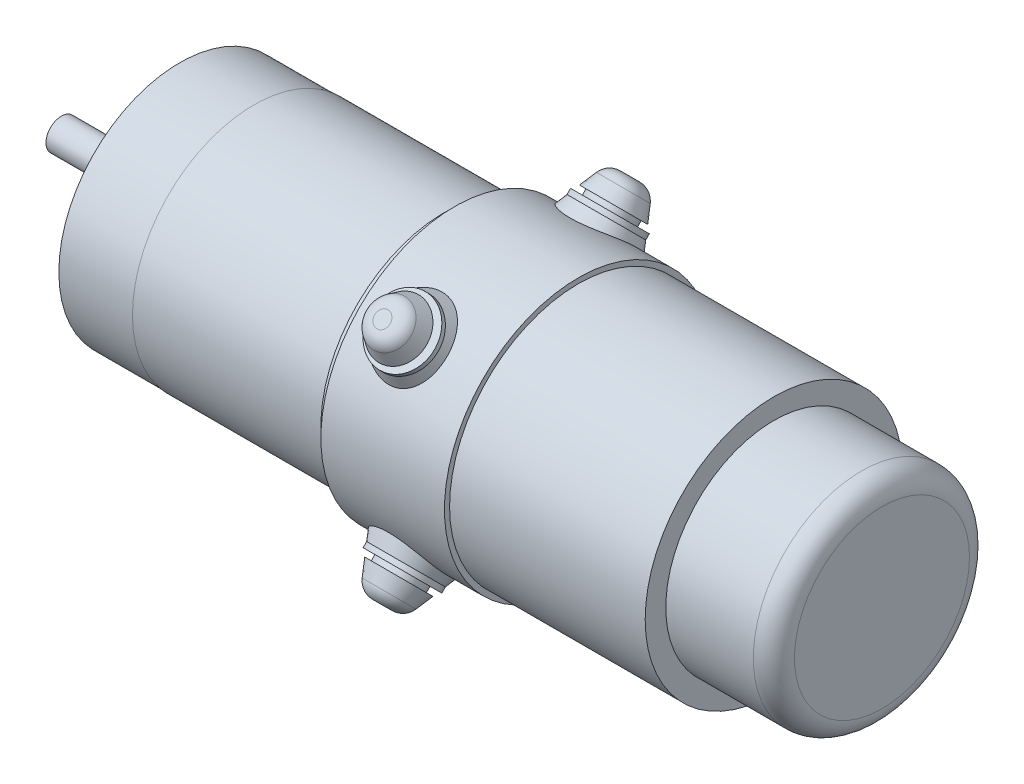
SolidWorks part; units mm, degrees
ref_plane "Plan1" through (0, 0, 0) normal (0, 0, 1) x (1, 0, 0)
ref_plane "Plan2" through (0, 0, 0) normal (0, 1, 0) x (1, 0, 0)
ref_plane "Plan3" through (0, 0, 0) normal (1, 0, 0) x (0, 0, -1)
sketch "Esquisse1" plane through (0, 0, 0) normal (0, 0, 1) x (1, 0, 0)
  line L0 (0, 0) -> (0, 17)
  line L1 (-4, 21) -> (-21, 21)
  line L2 (-139.4, 3) -> (-159.4, 3)
  line L3 (-159.4, 3) -> (-159.4, 0)
  line L4 (-159.4, 0) -> (-134.2475, 0)
  line L5 (-59, 25) -> (-59, 26)
  line L6 (-59, 26) -> (-83, 26)
  line L7 (-4.2299, 0) -> (-4.2299, 17)
  line L8 (-21, 21) -> (-21, 25)
  line L9 (-21, 25) -> (-59, 25)
  line L10 (-83, 26) -> (-83, 24)
  line L11 (-83, 24) -> (-85, 24)
  line L12 (-85, 24) -> (-85, 23.6)
  line L13 (-85, 23.6) -> (-122, 23.6)
  line L14 (-122, 23.6) -> (-122, 23.5)
  line L15 (-122, 23.5) -> (-136.4, 23.5)
  line L16 (-4.2299, 17) -> (-24.6821, 17)
  line L17 (-24.6821, 17) -> (-24.6821, 21)
  line L18 (-136.4, 23.5) -> (-136.4, 12.5)
  line L19 (0, 0) -> (-210.505, 0) construction
  line L20 (-136.4, 12.5) -> (-139.4, 12.5)
  line L21 (-139.4, 12.5) -> (-139.4, 3)
  line L22 (-24.6821, 21) -> (-134.2475, 21)
  line L23 (-134.2475, 21) -> (-134.2475, 0)
  line L26 (0, 0) -> (-4.2299, 0)
  arc A0 (0, 17) -> (-4, 21) centre (-4, 17) ccw
  dimension "D19" = 4
  dimension "D1" = 21
  dimension "D2" = 21
  dimension "D3" = 37
  dimension "D4" = 3
  dimension "D5" = 20
  dimension "D6" = 26
  dimension "D7" = 38
  dimension "D9" = 62
  dimension "D10" = 2
  dimension "D12" = 115.4
  dimension "D13" = 25
  dimension "D14" = 23.6
  dimension "D15" = 23.5
  dimension "D18" = 24
  dimension "D20" = 12.5
  dimension "D21" = 3
revolve "Base-Révolution" add sketch "Esquisse1" angle 360 about L19
ref_plane "Plan4" through (0, 0, 0) normal (0, 0.7071, 0.7071) x (-1, 0, 0)
ref_plane "Plan5" through (0, 24.0416, 24.0416) normal (0, 0.7071, 0.7071) x (-1, 0, 0)
sketch "Esquisse3" plane through (0, 24.0416, 24.0416) normal (0, 0.7071, 0.7071) x (-1, 0, 0)
  line L0 (0, 0) -> (210.505, 0) construction
  line L1 (83, -25) -> (83, 25) construction
  circle A0 centre (73, 0) radius 3.5
  dimension "D1" = 7
  dimension "D2" = 10
extrude "Boss.-Extru.2" add sketch "Esquisse3" against normal up to next draft 23
fillet "Congé1" radius 3 1 edges at (-73, 21.5668, 26.5165)
ref_plane "Plan6" through (0, 20.1525, 20.1525) normal (0, 0.7071, 0.7071) x (-1, 0, 0)
sketch "Esquisse4" plane through (0, 20.1525, 20.1525) normal (0, 0.7071, 0.7071) x (-1, 0, 0)
  circle A0 centre (73, 0) radius 6.25
  circle A1 centre (73, 0) radius 4.2759 construction
  dimension "D1" = 12.5
extrude "Boss.-Extru.3" add sketch "Esquisse4" against normal up to next
sketch "Esquisse5" plane through (0, 20.1525, 20.1525) normal (0, 0.7071, 0.7071) x (-1, 0, 0)
  circle A0 centre (73, 0) radius 5.8346
  circle A1 centre (73, 0) radius 5.8346 construction
  circle A2 centre (73, 0) radius 4.38
  dimension "D1" = 8.76
extrude "Enlèv. mat.-Extru.1" cut sketch "Esquisse5" along normal blind 1
pattern_circular "Répétition circulaire1" count 4 every 90 about axis through (0, 0, 0) along (1, 0, 0) of "Enlèv. mat.-Extru.1", "Boss.-Extru.3", "Congé1", "Boss.-Extru.2"
hole_wizard "Trou taraudé M41" positions "Esquisse7" profile "Esquisse6" tap size "M4" standard "ISO"
sketch "Esquisse7" plane through (-136.4, 0, 0) normal (-1, 0, 0) x (0, 0, 1)
  line L0 (18.3848, 18.3848) -> (19.4606, 19.4606) construction
  circle A0 centre (0, 0) radius 18 construction
  point P0 (12.7279, 12.7279)
  dimension "D1" = 36
sketch "Esquisse6" plane through (-136.4, 12.7279, 12.7279) normal (0, 1, 0) x (0, 0, 1)
  line L0 (0, 0) -> (0, 9.4914)
  line L1 (0, 9.4914) -> (1.65, 8.5)
  line L2 (1.65, 8.5) -> (1.65, 0)
  line L5 (1.65, 0) -> (0, 0)
  line L10 (0, 9.4914) -> (-1.65, 8.5) construction
  line L11 (0, -6.35) -> (0, 107.95) construction
  dimension "Diamètre du trou pour taraudage" = 3.3
  dimension "Profondeur du trou pour taraudage" = 8.5
  dimension "Angle de pointe" = 118
pattern_circular "Répétition circulaire2" count 4 over 360 about axis through (0, 0, 0) along (1, 0, 0) of "Trou taraudé M41"
